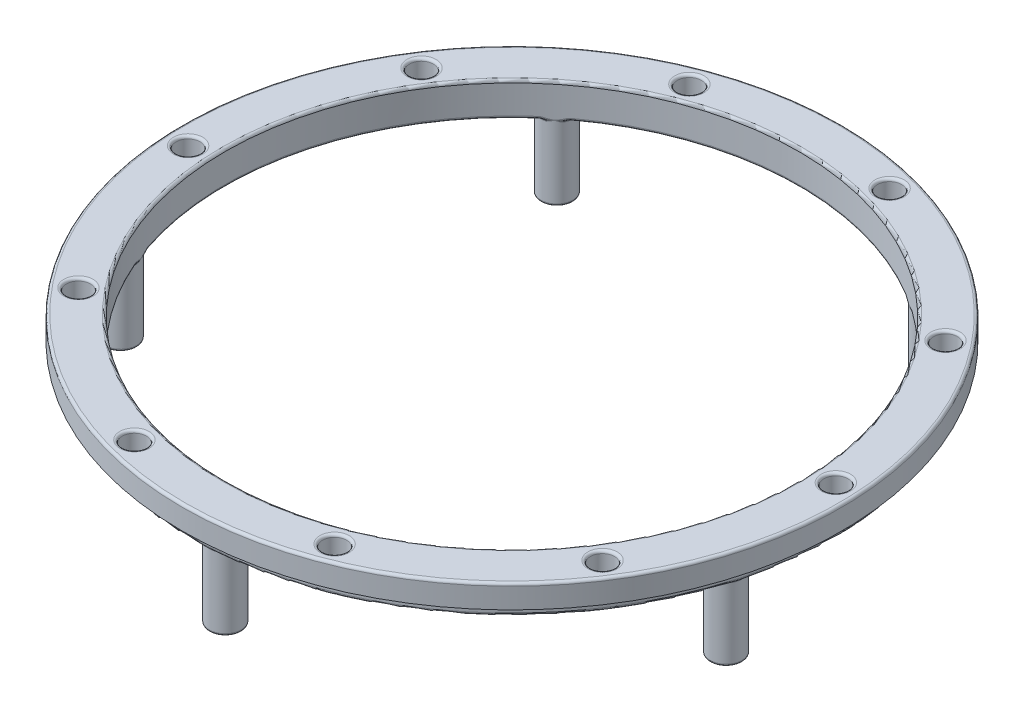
SolidWorks part; units mm, degrees
ref_plane "Front Plane" through (0, 0, 0) normal (0, 0, 1) x (1, 0, 0)
ref_plane "Top Plane" through (0, 0, 0) normal (0, 1, 0) x (1, 0, 0)
ref_plane "Right Plane" through (0, 0, 0) normal (1, 0, 0) x (0, 0, -1)
body saved out of another part "Stock-new goddard iris-1"
fillet "Fillet1" radius 0.25 38 edges at (22.4834, -1.5875, -17.0726) (28.8857, -1.5875, -0.3818) (24.2547, -1.5875, 16.8846) (10.3592, -1.5875, 28.1313) (-7.4931, -1.5875, 29.0626) (-22.4834, -1.5875, 19.3226) (-28.8857, -1.5875, 2.6318) (-24.2547, -1.5875, -14.6346) (-10.3592, -1.5875, -25.8813) (0, 1.5875, 26.925) (0, 1.5875, 30.925) (22.4834, 1.5875, -17.0726) (28.8857, 1.5875, -0.3818) (24.2547, 1.5875, 16.8846) (10.3592, 1.5875, 28.1313) (-7.4931, 1.5875, 29.0626) (-22.4834, 1.5875, 19.3226) (-28.8857, 1.5875, 2.6318) (-24.2547, 1.5875, -14.6346) (-10.3592, 1.5875, -25.8813) (-17.2402, -1.5875, -20.6817) (-16.635, -1.5875, -21.1715) (14.3419, -1.5875, -22.7874) (14.9948, -1.5875, -22.3632) (26.104, -1.5875, 6.5983) (25.9023, -1.5875, 7.3503) (1.7912, -1.5875, 26.8654) (1.0137, -1.5875, 26.9059) (-24.9969, -1.5875, 10.0054) (-25.2758, -1.5875, 9.2785) (0, -1.5875, -30.225) (7.4931, -1.5875, -26.8126) (-26.0059, -1.5875, -6.975) (-14.6699, -1.5875, 22.5776) (16.9394, -1.5875, 20.9288) (25.139, -1.5875, -9.6429) (-1.4026, -1.5875, -26.8884) (7.4931, 1.5875, -26.8126)
